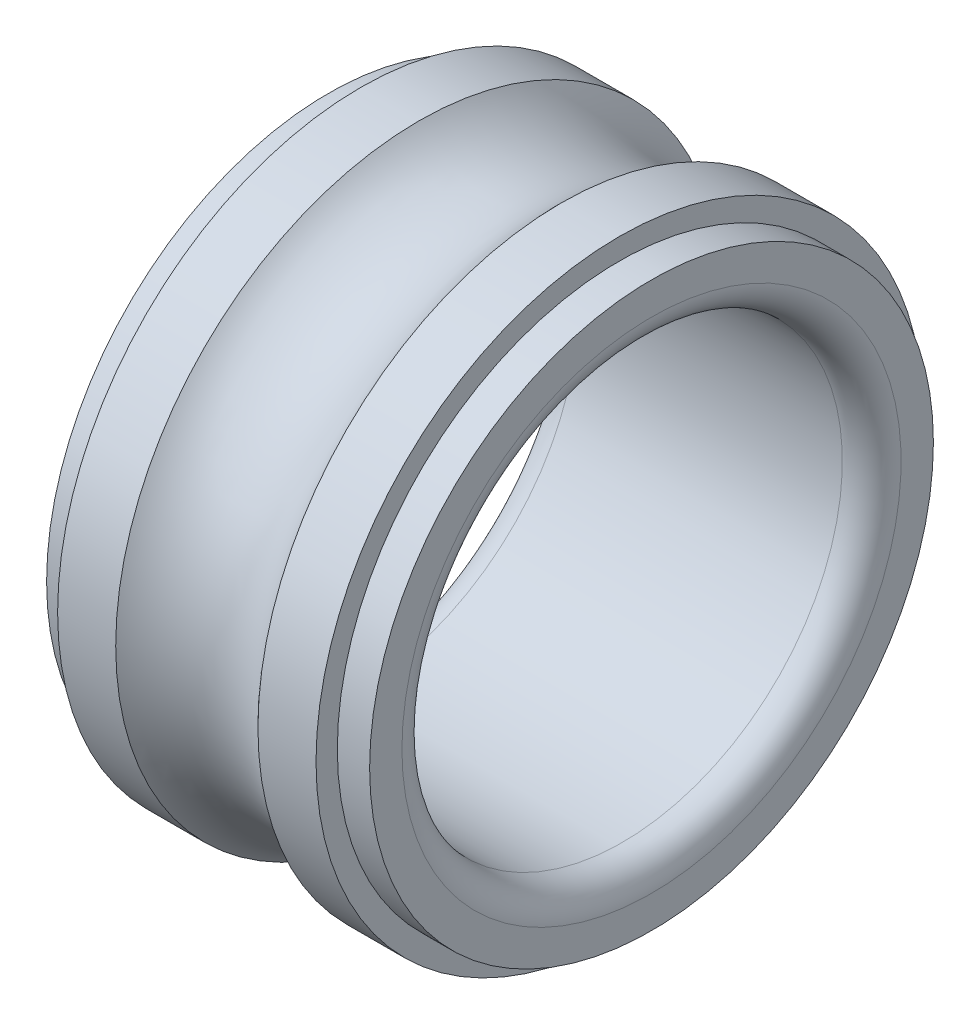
SolidWorks part; units mm, degrees
ref_plane "Face" through (0, 0, 0) normal (0, 0, 1) x (1, 0, 0)
ref_plane "Dessus" through (0, 0, 0) normal (0, 1, 0) x (1, 0, 0)
ref_plane "Droite" through (0, 0, 0) normal (1, 0, 0) x (0, 0, -1)
sketch "Esquisse1" plane through (0, 0, 0) normal (0, 0, 1) x (1, 0, 0)
  line L0 (-13.9749, 0) -> (33.7467, 0) construction
  line L1 (0, 20.1779) -> (0, -21.1152) construction
  line L2 (2.4217, 10.325) -> (4.4, 10.325)
  line L3 (-4.4, 10.325) -> (-2.4217, 10.325)
  line L4 (-5.5, 9.6) -> (-5.5, 8.5)
  line L5 (-4.5, 7.5) -> (4.5, 7.5)
  line L6 (5.5, 9.6) -> (5.5, 8.5)
  line L7 (-4.4, 10.325) -> (-4.4, 9.6)
  line L8 (-4.4, 9.6) -> (-5.5, 9.6)
  line L9 (4.4, 9.6) -> (5.5, 9.6)
  line L10 (4.4, 10.325) -> (4.4, 9.6)
  arc A0 (-2.4217, 10.325) -> (2.4217, 10.325) centre (0, 12.5) ccw
  arc A1 (-5.5, 8.5) -> (-4.5, 7.5) centre (-4.5, 8.5) ccw
  arc A2 (4.5, 7.5) -> (5.5, 8.5) centre (4.5, 8.5) ccw
  dimension "D3" = 3.255
  dimension "D6" = 1
  dimension "D1" = 15
  dimension "D2" = 11
  dimension "D4" = 12.5
  dimension "D5" = 1.08
  dimension "D7" = 19.2
  dimension "D8" = 1.1
revolve "Base-Révolution" add sketch "Esquisse1" angle 360 about L0
